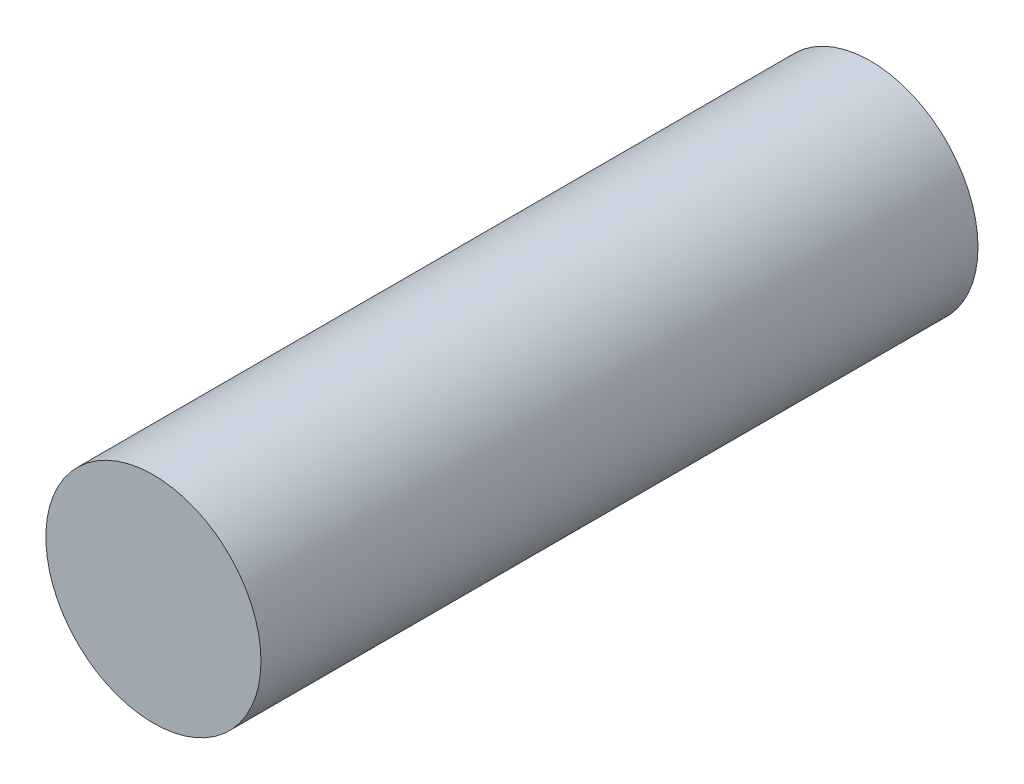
SolidWorks part; units mm, degrees
ref_plane "Plan de face" through (0, 0, 0) normal (0, 0, 1) x (1, 0, 0)
ref_plane "Plan de dessus" through (0, 0, 0) normal (0, 1, 0) x (1, 0, 0)
ref_plane "Plan de droite" through (0, 0, 0) normal (1, 0, 0) x (0, 0, -1)
sketch "Esquisse1" plane through (0, 0, 0) normal (0, 0, 1) x (1, 0, 0)
  circle A0 centre (0, 0) radius 1500
  dimension "D1" = 3000
extrude "Boss.-Extru.1" add sketch "Esquisse1" along normal mid plane 10000
